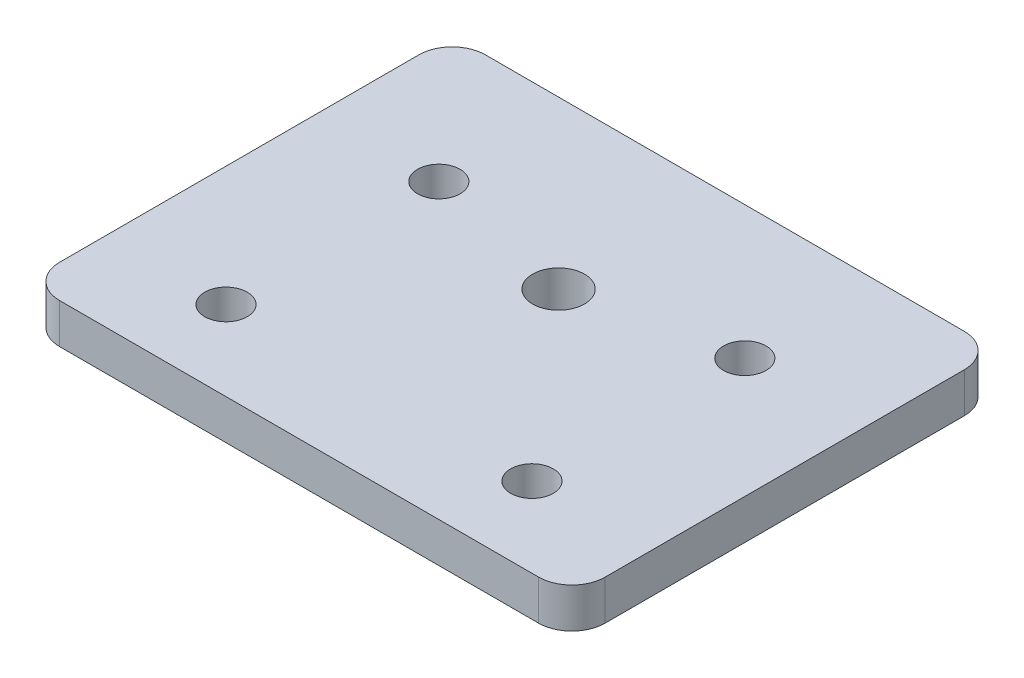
SolidWorks part; units mm, degrees
ref_plane "Plan de face" through (0, 0, 0) normal (0, 0, 1) x (1, 0, 0)
ref_plane "Plan de dessus" through (0, 0, 0) normal (0, 1, 0) x (1, 0, 0)
ref_plane "Plan de droite" through (0, 0, 0) normal (1, 0, 0) x (0, 0, -1)
sketch "Esquisse1" plane through (0, 0, 0) normal (0, 1, 0) x (1, 0, 0)
  line L1 (-41, 32) -> (41, 32)
  line L2 (-41, 32) -> (-41, -32)
  line L3 (-41, -32) -> (41, -32)
  line L4 (41, 32) -> (41, -32)
  line L6 (-41, -32) -> (41, 32) construction
  point P0 (0, 0)
  dimension "D1" = 82
  dimension "D3" = 64
extrude "Brut rectangle" add sketch "Esquisse1" along normal blind 6
sketch "Esquisse3" plane through (0, 6, 0) normal (0, 1, 0) x (-1, 0, 0)
  line L0 (0, -53.532) -> (0, 54.3173) construction
  line L1 (-41, -32) -> (41, -32) construction
  line L2 (-23, 20) -> (23, 20) construction
  line L3 (-23, 20) -> (-23, -12) construction
  line L4 (-23, -12) -> (23, -12) construction
  line L5 (23, 20) -> (23, -12) construction
  line L7 (-43.912, 0) -> (52.9431, 0) construction
  circle A0 centre (-23, -12) radius 3.2
  circle A1 centre (-23, 20) radius 3.2
  circle A2 centre (23, 20) radius 3.2
  circle A3 centre (23, -12) radius 3.2
  dimension "D14" = 6.4
  dimension "D3" = 20
  dimension "D2" = 46
  dimension "D4" = 32
extrude "passages vis" cut sketch "Esquisse3" against normal blind 10
sketch "Esquisse4" plane through (0, 6, 0) normal (0, 1, 0) x (-1, 0, 0)
  line L0 (0, 32) -> (0, -32) construction
  line L3 (41, 32) -> (-41, 32) construction
  line L4 (-41, -32) -> (41, -32) construction
  line L6 (-23, -12) -> (23, -12) construction
  circle A0 centre (0, -7) radius 3.9
  dimension "D2" = 7.8
  dimension "D1" = 5
extrude "axe bielle" cut sketch "Esquisse4" against normal blind 10
fillet "Fillet1" radius 5 4 edges at (41, 3, 32) (41, 3, -32) (-41, 3, -32) (-41, 3, 32)
